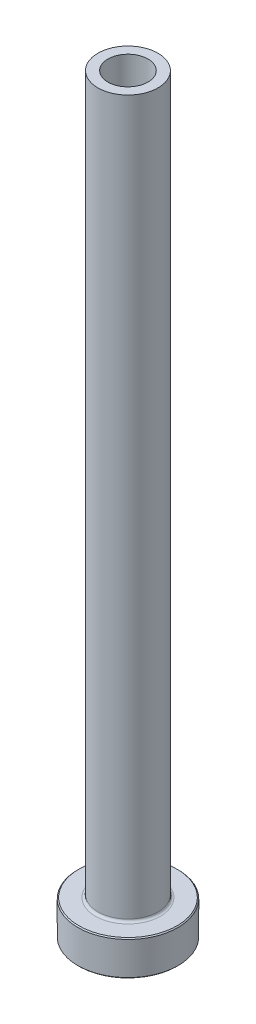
SolidWorks part; units mm, degrees
ref_plane "Front Plane" through (0, 0, 0) normal (0, 0, 1) x (1, 0, 0)
ref_plane "Top Plane" through (0, 0, 0) normal (0, 1, 0) x (1, 0, 0)
ref_plane "Right Plane" through (0, 0, 0) normal (1, 0, 0) x (0, 0, -1)
sketch "Sketch1" plane through (0, 0, 0) normal (0, 0, 1) x (1, 0, 0)
  line L0 (-4, 150) -> (-6, 150)
  line L1 (-6, 150) -> (-6, 7)
  line L2 (-6, 7) -> (-10, 7)
  line L3 (-10, 7) -> (-10, 0)
  line L4 (11, 0) -> (-11, 0) construction
  line L5 (-10, 0) -> (-4.25, 0)
  line L6 (-4, 105) -> (-4, 150)
  line L7 (0, 92.1877) -> (0, -15.5353) construction
  line L8 (0, -11) -> (0, 11) construction
  line L9 (-4, 105) -> (-4.25, 93)
  line L10 (-4.25, 93) -> (-4.25, 0)
  dimension "D1" = 0.25
  dimension "ID" = 8
  dimension "OD" = 12
  dimension "L" = 150
  dimension "H" = 20
  dimension "T" = 7
  dimension "N" = 45
  dimension "D2" = 12
revolve "Revolve1" add sketch "Sketch1" angle 360 about L7
fillet "Fillet1" radius 0.5 1 edges at (0, 7, 6)
chamfer "Chamfer1" distance 0.2 angle 45 2 edges at (0, 7, 10) (0, 0, 10)
chamfer "Chamfer3" distance 0.5 angle 45 1 edges at (0, 0, 4.25)
